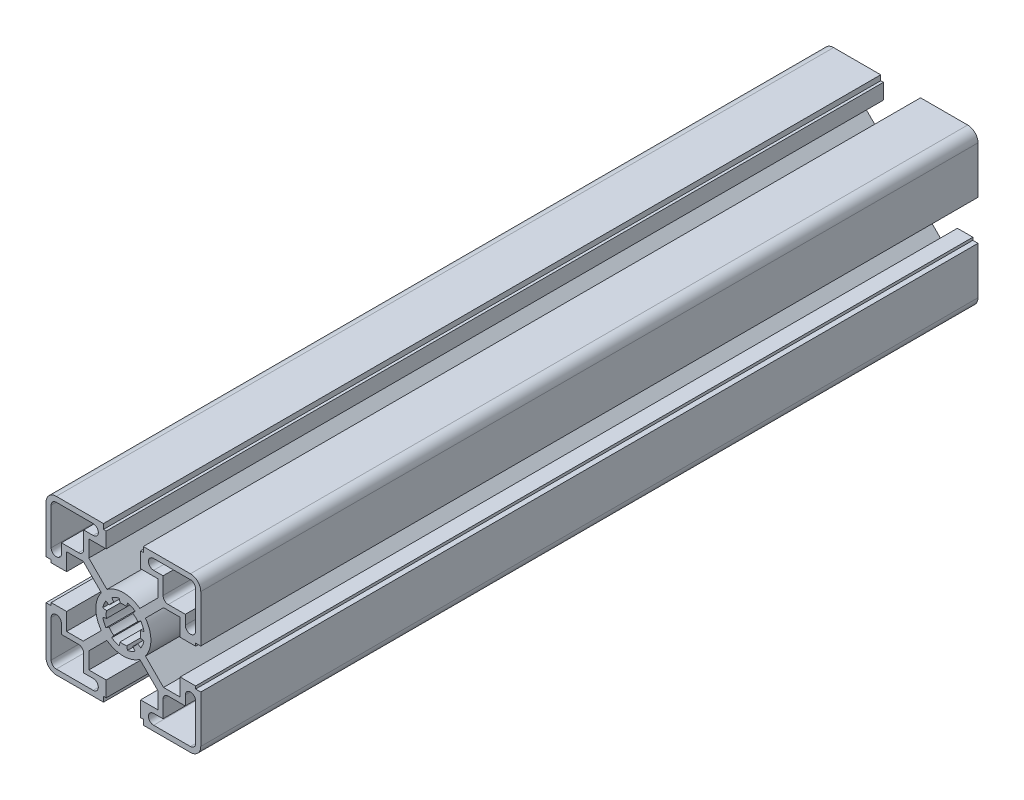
SolidWorks part; units mm, degrees
ref_plane "Front Plane" through (0, 0, 0) normal (0, 0, 1) x (1, 0, 0)
ref_plane "Top Plane" through (0, 0, 0) normal (0, 1, 0) x (1, 0, 0)
ref_plane "Right Plane" through (0, 0, 0) normal (1, 0, 0) x (0, 0, -1)
sketch "Sketch1" plane through (0, 0, 0) normal (0, 0, 1) x (1, 0, 0)
  line L2 (-19.5072, 22.5044) -> (-5.7912, 22.5044)
  line L3 (-5.7912, 22.5044) -> (-5.7912, 21.0058)
  line L4 (-5.7912, 21.0058) -> (-5.0038, 21.0058)
  line L6 (-5.0038, 21.0058) -> (-5.0038, 16.51)
  line L7 (-5.0038, 16.51) -> (-10.0457, 16.51)
  line L8 (-10.0457, 16.51) -> (-10.0457, 11.6801)
  line L9 (-10.0457, 11.6801) -> (-4.781, 6.4154)
  line L11 (-11.6801, 10.0457) -> (-6.4154, 4.781)
  line L12 (-16.51, 10.0457) -> (-11.6801, 10.0457)
  line L13 (-16.51, 5.0038) -> (-16.51, 10.0457)
  line L14 (-21.0058, 5.0038) -> (-16.51, 5.0038)
  line L15 (-21.0058, 5.7912) -> (-21.0058, 5.0038)
  line L16 (-22.5044, 5.7912) -> (-21.0058, 5.7912)
  line L17 (-22.5044, 19.5072) -> (-22.5044, 5.7912)
  line L18 (-18.0086, 11.5443) -> (-13.0429, 11.5443)
  line L19 (-18.0086, 11.5443) -> (-18.0086, 8.7884)
  line L20 (-11.5443, 18.0086) -> (-11.5443, 13.0429)
  line L21 (-21.0058, 19.5072) -> (-21.0058, 8.7884)
  line L23 (-11.5443, 18.0086) -> (-8.7884, 18.0086)
  line L24 (-19.5072, 21.0058) -> (-8.7884, 21.0058)
  line L25 (1.1893, 5.9789) -> (0.9762, 4.9077)
  line L26 (-1.1893, 5.9789) -> (-0.9762, 4.9077)
  line L27 (5.0686, 3.3868) -> (4.1605, 2.78)
  line L28 (3.3868, 5.0686) -> (2.78, 4.1605)
  line L29 (5.9789, -1.1893) -> (4.9077, -0.9762)
  line L30 (5.9789, 1.1893) -> (4.9077, 0.9762)
  line L31 (3.3868, -5.0686) -> (2.78, -4.1605)
  line L32 (5.0686, -3.3868) -> (4.1605, -2.78)
  line L33 (-1.1893, -5.9789) -> (-0.9762, -4.9077)
  line L34 (1.1893, -5.9789) -> (0.9762, -4.9077)
  line L35 (-5.0686, -3.3868) -> (-4.1605, -2.78)
  line L36 (-3.3868, -5.0686) -> (-2.78, -4.1605)
  line L37 (-5.9789, 1.1893) -> (-4.9077, 0.9762)
  line L38 (-5.9789, -1.1893) -> (-4.9077, -0.9762)
  line L39 (-3.3868, 5.0686) -> (-2.78, 4.1605)
  line L40 (-5.0686, 3.3868) -> (-4.1605, 2.78)
  line L41 (11.5443, 18.0086) -> (8.7884, 18.0086)
  line L42 (19.5072, 21.0058) -> (8.7884, 21.0058)
  line L43 (19.5072, 22.5044) -> (5.7912, 22.5044)
  line L44 (5.7912, 22.5044) -> (5.7912, 21.0058)
  line L45 (5.7912, 21.0058) -> (5.0038, 21.0058)
  line L46 (5.0038, 21.0058) -> (5.0038, 16.51)
  line L47 (5.0038, 16.51) -> (10.0457, 16.51)
  line L48 (10.0457, 16.51) -> (10.0457, 11.6801)
  line L49 (10.0457, 11.6801) -> (4.781, 6.4154)
  line L50 (11.6801, 10.0457) -> (6.4154, 4.781)
  line L51 (21.0058, 19.5072) -> (21.0058, 8.7884)
  line L52 (11.5443, 18.0086) -> (11.5443, 13.0429)
  line L53 (18.0086, 11.5443) -> (18.0086, 8.7884)
  line L54 (18.0086, 11.5443) -> (13.0429, 11.5443)
  line L55 (22.5044, 19.5072) -> (22.5044, 5.7912)
  line L56 (22.5044, 5.7912) -> (21.0058, 5.7912)
  line L57 (21.0058, 5.7912) -> (21.0058, 5.0038)
  line L58 (21.0058, 5.0038) -> (16.51, 5.0038)
  line L59 (16.51, 5.0038) -> (16.51, 10.0457)
  line L60 (16.51, 10.0457) -> (11.6801, 10.0457)
  line L61 (16.51, -10.0457) -> (11.6801, -10.0457)
  line L62 (16.51, -5.0038) -> (16.51, -10.0457)
  line L63 (21.0058, -5.0038) -> (16.51, -5.0038)
  line L64 (21.0058, -5.7912) -> (21.0058, -5.0038)
  line L65 (22.5044, -5.7912) -> (21.0058, -5.7912)
  line L66 (22.5044, -19.5072) -> (22.5044, -5.7912)
  line L67 (18.0086, -11.5443) -> (13.0429, -11.5443)
  line L68 (18.0086, -11.5443) -> (18.0086, -8.7884)
  line L69 (11.5443, -18.0086) -> (11.5443, -13.0429)
  line L70 (21.0058, -19.5072) -> (21.0058, -8.7884)
  line L71 (11.6801, -10.0457) -> (6.4154, -4.781)
  line L72 (10.0457, -11.6801) -> (4.781, -6.4154)
  line L73 (10.0457, -16.51) -> (10.0457, -11.6801)
  line L74 (5.0038, -16.51) -> (10.0457, -16.51)
  line L75 (5.0038, -21.0058) -> (5.0038, -16.51)
  line L76 (5.7912, -21.0058) -> (5.0038, -21.0058)
  line L77 (5.7912, -22.5044) -> (5.7912, -21.0058)
  line L78 (19.5072, -22.5044) -> (5.7912, -22.5044)
  line L79 (19.5072, -21.0058) -> (8.7884, -21.0058)
  line L80 (11.5443, -18.0086) -> (8.7884, -18.0086)
  line L81 (-11.5443, -18.0086) -> (-8.7884, -18.0086)
  line L82 (-19.5072, -21.0058) -> (-8.7884, -21.0058)
  line L83 (-19.5072, -22.5044) -> (-5.7912, -22.5044)
  line L84 (-5.7912, -22.5044) -> (-5.7912, -21.0058)
  line L85 (-5.7912, -21.0058) -> (-5.0038, -21.0058)
  line L86 (-5.0038, -21.0058) -> (-5.0038, -16.51)
  line L87 (-5.0038, -16.51) -> (-10.0457, -16.51)
  line L88 (-10.0457, -16.51) -> (-10.0457, -11.6801)
  line L89 (-10.0457, -11.6801) -> (-4.781, -6.4154)
  line L90 (-11.6801, -10.0457) -> (-6.4154, -4.781)
  line L91 (-21.0058, -19.5072) -> (-21.0058, -8.7884)
  line L92 (-11.5443, -18.0086) -> (-11.5443, -13.0429)
  line L93 (-18.0086, -11.5443) -> (-18.0086, -8.7884)
  line L94 (-18.0086, -11.5443) -> (-13.0429, -11.5443)
  line L95 (-22.5044, -19.5072) -> (-22.5044, -5.7912)
  line L96 (-22.5044, -5.7912) -> (-21.0058, -5.7912)
  line L97 (-21.0058, -5.7912) -> (-21.0058, -5.0038)
  line L98 (-21.0058, -5.0038) -> (-16.51, -5.0038)
  line L99 (-16.51, -5.0038) -> (-16.51, -10.0457)
  line L100 (-16.51, -10.0457) -> (-11.6801, -10.0457)
  arc A0 (-22.5044, 19.5072) -> (-19.5072, 22.5044) centre (-19.5072, 19.5072) cw
  arc A1 (-21.0058, 8.7884) -> (-18.0086, 8.7884) centre (-19.5072, 8.7884) ccw
  arc A2 (-21.0058, 19.5072) -> (-19.5072, 21.0058) centre (-19.5072, 19.5072) cw
  arc A3 (-8.7884, 21.0058) -> (-8.7884, 18.0086) centre (-8.7884, 19.5072) cw
  arc A4 (-11.5443, 13.0429) -> (-13.0429, 11.5443) centre (-13.0429, 13.0429) cw
  arc A5 (6.4154, -4.781) -> (6.4154, 4.781) centre (0, 0) ccw
  arc A6 (0.9762, 4.9077) -> (-0.9762, 4.9077) centre (0, 0) ccw
  arc A7 (-5.0686, 3.3868) -> (-5.9789, 1.1893) centre (0, 0) ccw
  arc A8 (4.1605, 2.78) -> (2.78, 4.1605) centre (0, 0) ccw
  arc A9 (4.9077, -0.9762) -> (4.9077, 0.9762) centre (0, 0) ccw
  arc A10 (2.78, -4.1605) -> (4.1605, -2.78) centre (0, 0) ccw
  arc A11 (-0.9762, -4.9077) -> (0.9762, -4.9077) centre (0, 0) ccw
  arc A12 (-4.1605, -2.78) -> (-2.78, -4.1605) centre (0, 0) ccw
  arc A13 (-4.9077, 0.9762) -> (-4.9077, -0.9762) centre (0, 0) ccw
  arc A14 (-2.78, 4.1605) -> (-4.1605, 2.78) centre (0, 0) ccw
  arc A15 (-5.9789, -1.1893) -> (-5.0686, -3.3868) centre (0, 0) ccw
  arc A16 (-3.3868, -5.0686) -> (-1.1893, -5.9789) centre (0, 0) ccw
  arc A17 (1.1893, -5.9789) -> (3.3868, -5.0686) centre (0, 0) ccw
  arc A18 (5.0686, -3.3868) -> (5.9789, -1.1893) centre (0, 0) ccw
  arc A19 (5.9789, 1.1893) -> (5.0686, 3.3868) centre (0, 0) ccw
  arc A20 (3.3868, 5.0686) -> (1.1893, 5.9789) centre (0, 0) ccw
  arc A21 (-1.1893, 5.9789) -> (-3.3868, 5.0686) centre (0, 0) ccw
  arc A22 (8.7884, 21.0058) -> (8.7884, 18.0086) centre (8.7884, 19.5072) ccw
  arc A23 (21.0058, 19.5072) -> (19.5072, 21.0058) centre (19.5072, 19.5072) ccw
  arc A24 (22.5044, 19.5072) -> (19.5072, 22.5044) centre (19.5072, 19.5072) ccw
  arc A25 (11.5443, 13.0429) -> (13.0429, 11.5443) centre (13.0429, 13.0429) ccw
  arc A26 (21.0058, 8.7884) -> (18.0086, 8.7884) centre (19.5072, 8.7884) cw
  arc A27 (21.0058, -8.7884) -> (18.0086, -8.7884) centre (19.5072, -8.7884) ccw
  arc A28 (11.5443, -13.0429) -> (13.0429, -11.5443) centre (13.0429, -13.0429) cw
  arc A29 (22.5044, -19.5072) -> (19.5072, -22.5044) centre (19.5072, -19.5072) cw
  arc A30 (21.0058, -19.5072) -> (19.5072, -21.0058) centre (19.5072, -19.5072) cw
  arc A31 (8.7884, -21.0058) -> (8.7884, -18.0086) centre (8.7884, -19.5072) cw
  arc A32 (-8.7884, -21.0058) -> (-8.7884, -18.0086) centre (-8.7884, -19.5072) ccw
  arc A33 (-21.0058, -19.5072) -> (-19.5072, -21.0058) centre (-19.5072, -19.5072) ccw
  arc A34 (-22.5044, -19.5072) -> (-19.5072, -22.5044) centre (-19.5072, -19.5072) ccw
  arc A35 (-11.5443, -13.0429) -> (-13.0429, -11.5443) centre (-13.0429, -13.0429) ccw
  arc A36 (-21.0058, -8.7884) -> (-18.0086, -8.7884) centre (-19.5072, -8.7884) cw
  arc A37 (4.781, 6.4154) -> (-4.781, 6.4154) centre (0, 0) ccw
  arc A38 (-4.781, -6.4154) -> (4.781, -6.4154) centre (0, 0) ccw
  arc A39 (-6.4154, 4.781) -> (-6.4154, -4.781) centre (0, 0) ccw
extrude "Boss-Extrude1" add sketch "Sketch1" along normal mid plane 226.06
